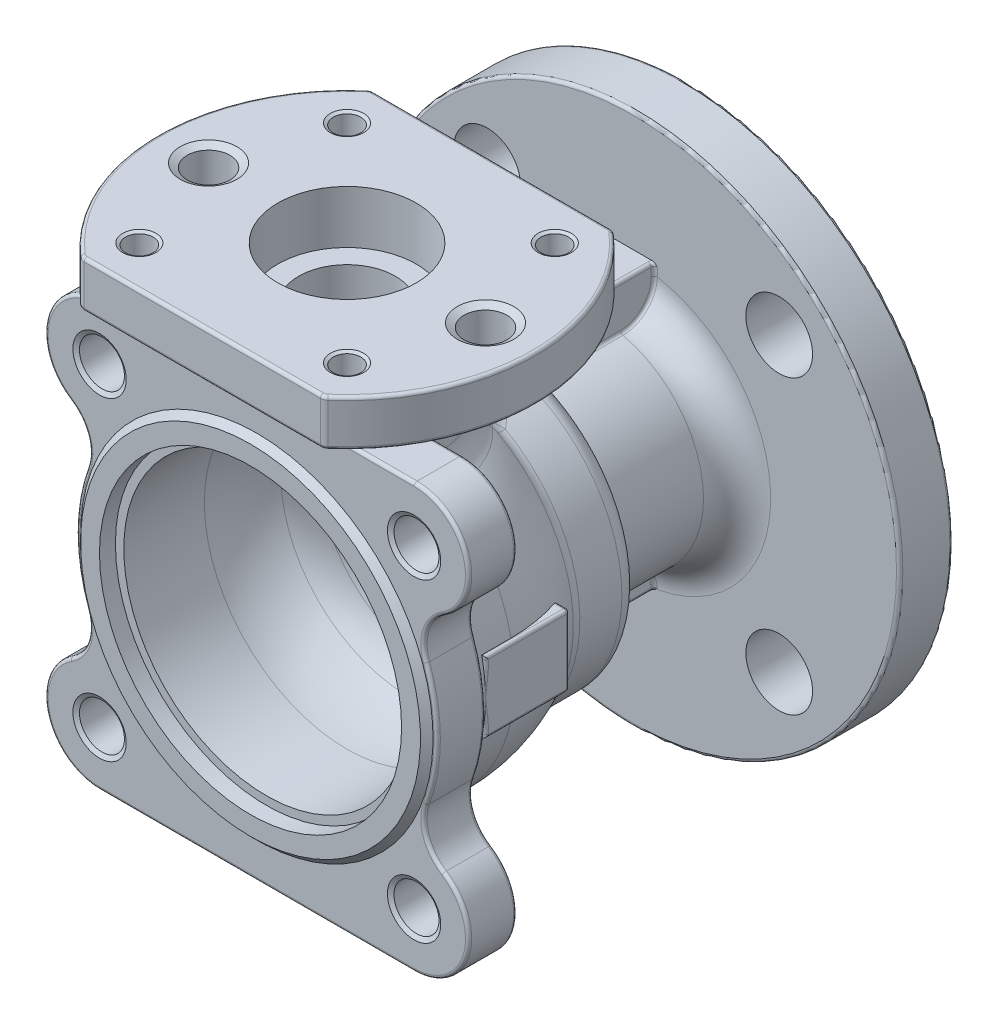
SolidWorks part; units mm, degrees
ref_plane "前基準面" through (0, 0, 0) normal (0, 0, 1) x (1, 0, 0)
ref_plane "上基準面" through (0, 0, 0) normal (0, 1, 0) x (1, 0, 0)
ref_plane "右基準面" through (0, 0, 0) normal (1, 0, 0) x (0, 0, -1)
sketch "草圖2" plane through (0, 0, 0) normal (1, 0, 0) x (0, 0, -1)
  line L0 (-22.2362, 0) -> (59.4835, 0) construction
  line L1 (0, 35.1384) -> (0, -10.5013) construction
  line L2 (80.9, 38.1) -> (80.9, 62.75)
  line L3 (80.15, 63.5) -> (68.95, 63.5)
  line L4 (68.2, 62.75) -> (68.2, 32.75)
  line L5 (60.2, 24.75) -> (39.5, 24.75)
  line L6 (35, 29.25) -> (35, 30.5)
  line L7 (-23, 40) -> (0, 40)
  line L8 (80.9, 38.1) -> (82.5, 36.5)
  line L9 (82.5, 36.5) -> (82.5, 0)
  line L10 (30.5, 35) -> (20.4939, 35)
  line L11 (-23, 40) -> (-23, 0)
  line L12 (-23, 0) -> (82.5, 0)
  arc A0 (0, 40) -> (18.4215, 35.5056) centre (0, 0) cw
  arc A1 (68.95, 63.5) -> (68.2, 62.75) centre (68.95, 62.75) ccw
  arc A2 (80.9, 62.75) -> (80.15, 63.5) centre (80.15, 62.75) ccw
  arc A3 (35, 30.5) -> (30.5, 35) centre (30.5, 30.5) ccw
  arc A4 (39.5, 24.75) -> (35, 29.25) centre (39.5, 29.25) cw
  arc A5 (68.2, 32.75) -> (60.2, 24.75) centre (60.2, 32.75) cw
  arc A6 (20.4939, 35) -> (18.4215, 35.5056) centre (20.4939, 39.5) cw
  circle A7 centre (0, 0) radius 31.5 construction
  dimension "D4" = 0.75
  dimension "D7" = 8
  dimension "D13" = 4.5
  dimension "D14" = 70
  dimension "D6" = 63
  dimension "D12" = 35
  dimension "D1" = 127
  dimension "D2" = 14.3
  dimension "D3" = 49.5
  dimension "D5" = 80
  dimension "D8" = 1.6
  dimension "D9" = 73
  dimension "D10" = 45
  dimension "D11" = 82.5
  dimension "D15" = 23
revolve "旋轉1" add sketch "草圖2" angle 360 about L0
sketch "草圖4" plane through (0, 0, -82.5) normal (0, 0, -1) x (-1, 0, 0)
  line L0 (-84.4162, 0) -> (82.427, 0) construction
  line L1 (0, 83.4216) -> (0, -80.4378) construction
  line L2 (0, 0) -> (59.427, 59.427) construction
  circle A0 centre (0, 0) radius 49.2 construction
  circle A1 centre (34.7897, 34.7897) radius 7.95
  circle A2 centre (34.7897, -34.7897) radius 7.95
  circle A3 centre (-34.7897, -34.7897) radius 7.95
  circle A4 centre (-34.7897, 34.7897) radius 7.95
  dimension "D2" = 98.4
  dimension "D3" = 15.9
  dimension "D1" = 45
extrude "除料-伸長1" cut sketch "草圖4" against normal up to surface (14.3 mm away)
sketch "草圖21" plane through (0, 0, 0) normal (0, 1, 0) x (1, 0, 0)
  circle A0 centre (0, 0) radius 21.5
  dimension "D1" = 43
extrude "伸長10" add sketch "草圖21" along normal blind 70.5
sketch "草圖5" plane through (0, 0, 23) normal (0, 0, 1) x (1, 0, 0)
  line L0 (-14.4826, 0) -> (14.4826, 0) construction
  line L1 (0, 13.75) -> (0, -13.75) construction
  line L4 (0, 0) -> (41.9138, 41.9138) construction
  line L5 (-37.4767, 50.4767) -> (37.4767, 50.4767)
  line L6 (-37.4767, -50.4767) -> (37.4767, -50.4767)
  circle A1 centre (0, 0) radius 53 construction
  circle A3 centre (0, 0) radius 43
  circle A4 centre (0, 0) radius 43 construction
  arc A5 (44.4555, 26.5087) -> (37.4767, 50.4767) centre (37.4767, 37.4767) ccw
  arc A6 (37.4767, -50.4767) -> (44.4555, -26.5087) centre (37.4767, -37.4767) ccw
  arc A7 (-44.4555, -26.5087) -> (-37.4767, -50.4767) centre (-37.4767, -37.4767) ccw
  arc A8 (-37.4767, 50.4767) -> (-44.4555, 26.5087) centre (-37.4767, 37.4767) ccw
  arc A9 (-44.4555, -26.5087) -> (-40.4231, -14.662) centre (-49.8238, -18.0718) ccw
  arc A10 (-40.4231, 14.662) -> (-44.4555, 26.5087) centre (-49.8238, 18.0718) ccw
  arc A11 (44.4555, 26.5087) -> (40.4231, 14.662) centre (49.8238, 18.0718) ccw
  arc A12 (40.4231, -14.662) -> (44.4555, -26.5087) centre (49.8238, -18.0718) ccw
  arc A13 (40.4231, -14.662) -> (40.4231, 14.662) centre (0, 0) ccw
  arc A14 (-40.4231, 14.662) -> (-40.4231, -14.662) centre (0, 0) ccw
  dimension "D1" = 106
  dimension "D3" = 3
  dimension "D4" = 10
  dimension "D2" = 13
extrude "伸長1" add sketch "草圖5" against normal blind 13
fillet "圓角13" radius 2 3 edges at (-19.0329, 42.8292, 10) (19.0329, 42.8292, 10) (0, -40, 10)
sketch "草圖17" plane through (0, 0, 0) normal (1, 0, 0) x (0, 0, -1)
  line L0 (-10, -40) -> (-10, -35.1817) construction
  line L1 (-7, 8.5) -> (13, 8.5)
  line L2 (-7, 8.5) -> (-7, -8.5)
  line L3 (-7, -8.5) -> (13, -8.5)
  line L4 (13, 8.5) -> (13, -8.5)
  line L5 (-10.7403, 0) -> (15.3179, 0) construction
  dimension "D1" = 20
  dimension "D2" = 17
  dimension "D3" = 3
extrude "伸長6" add sketch "草圖17" along normal mid plane 80
sketch "草圖20" plane through (0, 0, 0) normal (1, 0, 0) x (0, 0, -1)
  line L0 (-23, 82) -> (-23, 40.5)
  line L1 (-23, 40.5) -> (-21.5, 42)
  line L2 (-21.5, 42) -> (-21.5, 82)
  line L3 (-21.5, 82) -> (-23, 82)
  line L4 (-23, 14.662) -> (-23, -14.662) construction
  line L5 (0, 0) -> (-28.0643, 0) construction
  dimension "D1" = 1.5
  dimension "D2" = 45
  dimension "D3" = 84
  dimension "D4" = 40
revolve "除料-旋轉4" cut sketch "草圖20" angle 360 about L5
sketch "草圖22" plane through (0, 70.5, 0) normal (0, 1, 0) x (-1, 0, 0)
  line L0 (-28.1558, -34.5) -> (28.1558, -34.5)
  line L1 (-28.1558, 34.5) -> (28.1558, 34.5)
  line L2 (-35.8303, 0) -> (30.8757, 0) construction
  arc A0 (-29.4654, 34.0116) -> (-29.4654, -34.0116) centre (0, 0) ccw
  arc A1 (29.4654, -34.0116) -> (29.4654, 34.0116) centre (0, 0) ccw
  arc A2 (28.1558, -34.5) -> (29.4654, -34.0116) centre (28.1558, -32.5) ccw
  arc A3 (-28.1558, -34.5) -> (-29.4654, -34.0116) centre (-28.1558, -32.5) cw
  arc A4 (-28.1558, 34.5) -> (-29.4654, 34.0116) centre (-28.1558, 32.5) ccw
  arc A5 (28.1558, 34.5) -> (29.4654, 34.0116) centre (28.1558, 32.5) cw
  point P10 (28.892, -34.5)
  dimension "D2" = 45
  dimension "D3" = 2
  dimension "D1" = 69
extrude "伸長11" add sketch "草圖22" against normal blind 11
fillet "圓角7" radius 8 10 edges at (18.7163, 33.7305, -10.5807) (-18.7163, 33.7305, -10.5807) (-0.9078, 34.9882, 21.4808) (0, 59.5, 21.5) (20.4436, 34.7845, 9.1263) (-20.4436, 34.7845, 9.1263)
sketch "草圖18" plane through (0, 0, 0) normal (1, 0, 0) x (0, 0, -1)
  line L0 (-10, -44) -> (-10, 50.4767)
  line L1 (-7.3191, 50.4767) -> (-21.5, 50.4767) construction
  line L2 (68.2, -32.75) -> (68.2, 35)
  line L3 (0, -44) -> (-10, -44)
  line L4 (68.2, -32.75) -> (41.3901, -32.75)
  line L5 (-10, 26.5087) -> (-10, 50.4767) construction
  line L6 (-10, -50.4767) -> (-10, -26.5087) construction
  line L7 (-10, 50.4767) -> (20.0849, 50.4767)
  line L8 (68.2, 32.75) -> (68.2, -32.75) construction
  line L9 (68.2, 62.75) -> (68.2, -62.75) construction
  line L11 (68.2, 35) -> (43.2, 35)
  line L12 (20.2636, -39.0562) -> (30.5, -39.0562)
  line L13 (30.5, 35) -> (29.5, 35) construction
  line L17 (-11.1416, 0) -> (14.8431, 0) construction
  arc A0 (41.3901, -32.75) -> (37.9209, -34.7589) centre (41.3901, -36.75) ccw
  arc A1 (30.5, -39.0562) -> (37.9209, -34.7589) centre (30.5, -30.5) ccw
  arc A2 (43.2, 35) -> (20.0849, 50.4767) centre (43.2, 60) cw
  arc A4 (30.5, -35) -> (35, -30.5) centre (30.5, -30.5) ccw construction
  arc A10 (0, -44) -> (20.2636, -39.0562) centre (0, 0) ccw
  arc A11 (0, -44) -> (20.2636, -39.0562) centre (0, 0) ccw
  dimension "D1" = 4
  dimension "D3" = 25
  dimension "D4" = 25
  dimension "D2" = 4
extrude "伸長9" add sketch "草圖18" along normal mid plane 10
sketch "草圖14" plane through (0, 0, 0) normal (1, 0, 0) x (0, 0, -1)
  line L0 (-22.8364, 0) -> (59.624, 0) construction
  line L1 (-23, 36) -> (-19.2, 36)
  line L2 (-23, 40.5) -> (-23, -40.5) construction
  line L5 (-19.2, 36) -> (-19.2, 34)
  line L6 (-19.2, 34) -> (0, 34)
  line L9 (21.8, 29) -> (28.8, 29)
  line L10 (28.8, 29) -> (28.8, 19)
  line L11 (28.8, 19) -> (82.5, 19)
  line L12 (82.5, -36.5) -> (82.5, 36.5) construction
  line L13 (82.5, 19) -> (82.5, 0)
  line L14 (82.5, 0) -> (-23, 0)
  line L15 (-23, 0) -> (-23, 36)
  arc A0 (0, 34) -> (14.8169, 30.6016) centre (0, 0) cw
  arc A1 (21.8, 29) -> (14.8169, 30.6016) centre (21.8, 45.024) cw
  dimension "D4" = 58
  dimension "D3" = 7
  dimension "D1" = 72
  dimension "D2" = 68
  dimension "D5" = 38
  dimension "D8" = 28.8
  dimension "D9" = 3.8
revolve "除料-旋轉3" cut sketch "草圖14" angle 360 about L0
sketch "草圖15" plane through (0, 0, 0) normal (1, 0, 0) x (0, 0, -1)
  line L0 (0, 74.9081) -> (0, -19.7138) construction
  line L2 (34.0116, 70.5) -> (-34.0116, 70.5) construction
  line L3 (14.5, 34.5) -> (17.5, 31.5)
  line L5 (16.5, 70.5) -> (16.5, 57.9)
  line L6 (16.5, 57.9) -> (11.5, 57.9)
  line L7 (11.5, 57.9) -> (11.5, 43.9)
  line L8 (11.5, 43.9) -> (14.5, 43.9)
  line L9 (14.5, 43.9) -> (14.5, 34.5)
  line L10 (17.5, 0) -> (0, 0)
  line L11 (0, 0) -> (0, 70.5)
  line L12 (0, 70.5) -> (16.5, 70.5)
  line L13 (17.5, 31.5) -> (17.5, 0)
  dimension "D1" = 45
  dimension "D2" = 33
  dimension "D3" = 23
  dimension "D4" = 29
  dimension "D5" = 36
  dimension "D6" = 12.6
  dimension "D7" = 26.6
  dimension "D8" = 35
revolve "除料-旋轉2" cut sketch "草圖15" angle 360 about L0
sketch "草圖27" plane through (0, 0, 21.5) normal (0, 0, 1) x (1, 0, 0)
  line L0 (0, 0) -> (34.0176, -34.0176) construction
  line L1 (0, 0) -> (35.1052, 0) construction
  circle A0 centre (0, 0) radius 53 construction
  dimension "D1" = 106
hole_wizard "1/2-13 螺紋孔1" positions "3D草圖4" profile "草圖28" tap size "1/2-13" standard "Ansi 英吋"
sketch3d "3D草圖4"
  line L0 (0, 0, 21.5) -> (34.0176, -34.0176, 21.5) construction
  circle A0 centre (0, 0, 21.5) radius 53 construction
  point P0 (37.4767, -37.4767, 21.5)
  point P6 (0, 0, 74.5)
sketch "草圖28" plane through (37.4767, -37.4767, 21.5) normal (1, 0, 0) x (0, -1, 0)
  line L0 (0, 0) -> (0, 16.4795)
  line L1 (0, 16.4795) -> (5.3581, 13.26)
  line L2 (5.3581, 13.26) -> (5.3581, 0.5727)
  line L3 (5.3581, 0.5727) -> (6.35, 0)
  line L5 (6.35, 0) -> (0, 0)
  line L6 (-5.3581, 0.5727) -> (-6.35, 0) construction
  line L10 (0, 16.4795) -> (-5.3581, 13.26) construction
  line L11 (0, -6.35) -> (0, 107.95) construction
  dimension "螺孔鑽直徑" = 10.7163
  dimension "螺孔鑽深度" = 13.26
  dimension "近端錐孔直徑" = 12.7
  dimension "近端錐孔角度" = 120
  dimension "導頭角度" = 118
pattern_circular "環狀複製排列5" count 4 over 360 about axis through (0, 0, 0) along (0, 0, 1) of "1/2-13 螺紋孔1"
sketch "草圖26" plane through (0, 70.5, 0) normal (0, 1, 0) x (-1, 0, 0)
  line L0 (-30.0297, 0) -> (28.7005, 0) construction
  line L1 (0, 0) -> (-21.1606, 21.1606) construction
  line L3 (0, -9.454) -> (0, 11.9354) construction
  line L5 (-33, 4.3025) -> (-33, -4.1692) construction
  line L6 (33, 4.3025) -> (33, -4.1692) construction
  circle A0 centre (0, 0) radius 35 construction
  dimension "D3" = 70
  dimension "D1" = 33
  dimension "D2" = 33
  dimension "D4" = 45
hole_wizard "5/16-18 螺紋孔1" positions "3D草圖3" profile "草圖13" tap size "5/16-18" standard "Ansi 英吋"
sketch3d "3D草圖3"
  line L1 (0, 70.5, 0) -> (21.1606, 70.5, 21.1606) construction
  circle A1 centre (0, 70.5, 0) radius 35 construction
  point P9 (24.7487, 70.5, 24.7487)
  point P15 (0, 105.5, 0)
sketch "草圖13" plane through (24.7487, 70.5, 24.7487) normal (1, 0, 0) x (0, 0, 1)
  line L0 (0, 0) -> (0, 12.9944)
  line L1 (0, 12.9944) -> (3.2639, 11.11)
  line L2 (3.2639, 11.11) -> (3.2639, 0.4106)
  line L3 (3.2639, 0.4106) -> (3.9751, 0)
  line L5 (3.9751, 0) -> (0, 0)
  line L6 (-3.2639, 0.4106) -> (-3.9751, 0) construction
  line L10 (0, 12.9944) -> (-3.2639, 11.11) construction
  line L11 (0, -6.35) -> (0, 107.95) construction
  dimension "螺孔鑽直徑" = 6.5278
  dimension "螺孔鑽深度" = 11.11
  dimension "近端錐孔直徑" = 7.9502
  dimension "近端錐孔角度" = 120
  dimension "導頭角度" = 120
pattern_circular "環狀複製排列6" count 4 over 360 about axis through (0, 0, 0) along (0, 1, 0) of "5/16-18 螺紋孔1"
hole_wizard "M12x1.75 螺紋孔1" positions "3D草圖6" profile "草圖30" tap size "M12x1.75" standard "Ansi 公制"
sketch3d "3D草圖6"
  line L1 (30.0297, 70.5, 0) -> (-28.7005, 70.5, 0) construction
  line L2 (33, 70.5, 4.3025) -> (33, 70.5, -4.1692) construction
  line L3 (-33, 70.5, 4.3025) -> (-33, 70.5, -4.1692) construction
  point P5 (33, 70.5, 0)
  point P13 (-33, 70.5, 0)
sketch "草圖30" plane through (33, 70.5, 0) normal (1, 0, 0) x (0, 0, 1)
  line L0 (0, 0) -> (0, 32.1945)
  line L1 (0, 32.1945) -> (5.1, 29.25)
  line L2 (5.1, 29.25) -> (5.1, 0.9526)
  line L3 (5.1, 0.9526) -> (6.75, 0)
  line L5 (6.75, 0) -> (0, 0)
  line L6 (-5.1, 0.9526) -> (-6.75, 0) construction
  line L10 (0, 32.1945) -> (-5.1, 29.25) construction
  line L11 (0, -6.35) -> (0, 107.95) construction
  dimension "螺孔鑽直徑" = 10.2
  dimension "螺孔鑽深度" = 29.25
  dimension "近端錐孔直徑" = 13.5
  dimension "近端錐孔角度" = 120
  dimension "導頭角度" = 120
fillet "圓角8" radius 2 2 edges at (-12.3468, 50.4767, 17.6013) (12.3468, 50.4767, 17.6013)
fillet "圓角11" radius 0.75 42 edges at (5, 33.683, -68.2) (5, -32.558, -68.2) (-5, -32.558, -68.2) (-5, 33.683, -68.2) (5, -37.585, -54.0917) (5, 38.7898, -55.348) (-5, -37.585, -54.0917) (-5, 38.7898, -55.348) (-5, 34.641, -29.6767) (-5, -34.641, -25.497) (5, 34.641, -29.6767) (5, -34.641, -25.497) (5, -27.3564, -26.8928) (5, 33.4236, -33.5643) (-5, -27.3564, -26.8928) (-5, 33.4236, -33.5643) (5, -29.4534, -35) (5, 29.4534, -35) (-5, -29.4534, -35) (-5, 29.4534, -35) (5, -32.0012, -42.7239) (5, 32.4178, -42.264) (-5, -32.0012, -42.7239) (-5, 32.4178, -42.264) (5, -39.6863, 4) (-5, -39.6863, 4) (5, -42.8507, 10) (-5, -42.8507, 10) (-5, 45.5638, -20.9105) (-5, 36.4245, -23.7562) (5, 24.2397, -49.85) (5, -24.2397, -49.85) (-5, 24.2397, -49.85) (-5, -24.2397, -49.85) (5, 45.5638, -20.9105) (5, 36.4245, -23.7562) (5, -38.536, -9.4857) (-5, -38.536, -9.4857) (-5, -43.5308, -21.764) (5, -43.5308, -21.764) (5, -43.2197, 6.6862) (-5, -43.2197, 6.6862)
fillet "圓角12" radius 0.75 18 edges at (-5, -32.75, -54.4201) (5, -32.75, -54.4201) (-5, -39.0562, -25.3818) (5, -39.0562, -25.3818) (-5, -37.9043, -34.7876) (5, -37.9043, -34.7876) (-5, -33.2885, -39.3857) (5, -33.2885, -39.3857) (-5.2197, -32.75, -67.9803) (5.2197, -32.75, -67.9803) (-5, 38.3771, -30.6521) (5, 38.3771, -30.6521) (-5.3223, 48.7424, -20.8781) (5.3624, 48.7941, -20.8521) (-5.2197, 35, -67.9803) (-5, 35, -55.325) (5.2197, 35, -67.9803) (5, 35, -55.325)
fillet "圓角6" radius 0.75 64 edges at (28.8547, 59.5, 34.3739) (0, 59.5, 34.5) (-28.8547, 59.5, 34.3739) (-45, 59.5, 0) (-28.8547, 59.5, -34.3739) (0, 59.5, -34.5) (28.8547, 59.5, -34.3739) (28.8547, 70.5, 34.3739) (0, 70.5, 34.5) (-28.8547, 70.5, 34.3739) (-45, 70.5, 0) (-28.8547, 70.5, -34.3739) (0, 70.5, -34.5) (28.8547, 70.5, -34.3739) (-29.7865, 50.4767, 10) (-49.9583, 41.111, 10) (-40.3572, 21.2941, 10) (-43, 0, 10) (-40.3572, -21.2941, 10) (-49.9583, -41.111, 10) (0, -50.4767, 10) (49.9583, -41.111, 10) (40.3572, -21.2941, 10) (43, 0, 10) (40.3572, 21.2941, 10) (29.7865, 50.4767, 10) (40.3572, 21.2941, 21.5) (43, 0, 21.5) (40.3572, -21.2941, 21.5) (49.9583, -41.111, 21.5) (0, -50.4767, 21.5) (-49.9583, -41.111, 21.5) (-40.3572, -21.2941, 21.5) (-43, 0, 21.5) (-40.3572, 21.2941, 21.5) (-49.9583, 41.111, 21.5) (-23.58, 50.4767, 21.5) (-1.8137, 50.4767, 21.5) (-6.6553, 50.4767, 21.5) (6.6553, 50.4767, 21.5) (1.8137, 50.4767, 21.5) (23.58, 50.4767, 21.5) (45, 59.5, 0) (45, 70.5, 0) (49.9583, 41.111, 10) (49.9583, 41.111, 21.5) (-40, -8.5, -3) (-40, 0, -13) (-40, 8.5, -3) (-40, -4.25, 7) (-40, 4.25, 7) (40, 8.5, -3) (40, 0, -13) (40, -8.5, -3) (40, 4.25, 7) (40, -4.25, 7) (-38.4306, 8.5, -13) (-38.4306, -8.5, -13) (38.4306, -8.5, -13) (38.4306, 8.5, -13) (-20.1012, 51.8328, 8.1391) (-21.7483, 50.4767, 9.9695) (20.1626, 51.4151, 8.5102) (21.7483, 50.4767, 9.9695)
sketch "草圖31" plane through (0, 0, 0) normal (1, 0, 0) x (0, 0, -1)
  line L0 (0, 0) -> (0, 54.3309) construction
